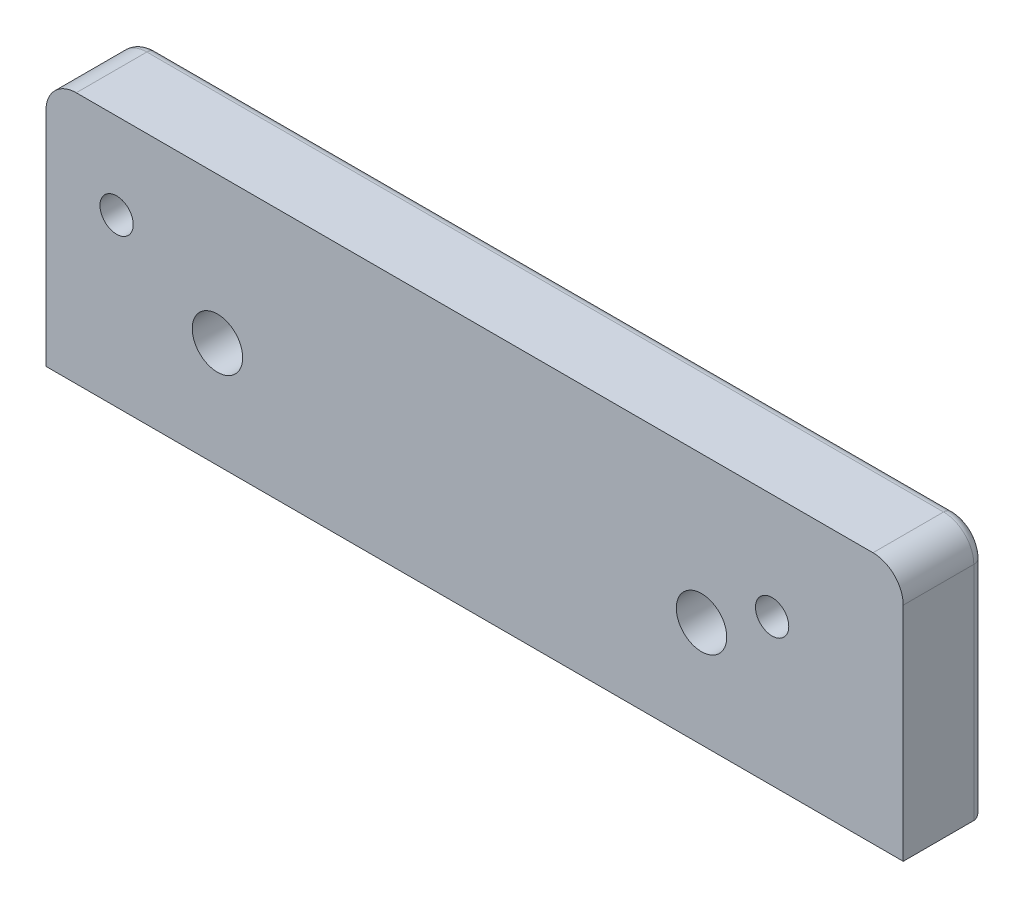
SolidWorks part; units mm, degrees
ref_plane "Plan1" through (0, 0, 0) normal (0, 0, 1) x (1, 0, 0)
ref_plane "Plan2" through (0, 0, 0) normal (0, 1, 0) x (1, 0, 0)
ref_plane "Plan3" through (0, 0, 0) normal (1, 0, 0) x (0, 0, -1)
sketch "Esquisse1" plane through (0, 0, 0) normal (0, 0, 1) x (1, 0, 0)
  line L0 (-42.5, -10.5) -> (42.5, -10.5)
  line L1 (-42.5, -10.5) -> (-42.5, 14.5)
  line L2 (42.5, 14.5) -> (-42.5, 14.5)
  line L3 (42.5, 14.5) -> (42.5, -10.5)
  dimension "D1" = 14.5
  dimension "D2" = 42.5
  dimension "D3" = 42.5
  dimension "D4" = 10.5
extrude "Base-Extrusion" add sketch "Esquisse1" along normal blind 8
fillet "Congé1" radius 3
fillet "Congé4" radius 1
sketch "Esquisse2" plane through (0, 0, 8) normal (0, 0, 1) x (1, 0, 0)
  line L0 (-25.5, 16) -> (-25.5, -15) construction
  line L1 (22.5, 16) -> (22.5, -19) construction
  line L2 (-37, 0) -> (34, 0) construction
  line L3 (-42.5, -10.5) -> (-42.5, 11.5) construction
  circle A0 centre (-25.5, 0) radius 2.5
  circle A1 centre (22.5, 0) radius 2.5
  dimension "D1" = 5
  dimension "D2" = 5
  dimension "D3" = 17
  dimension "D4" = 48
extrude "Enlèv. mat.-Extru.1" cut sketch "Esquisse2" against normal blind 8
sketch "Esquisse4" plane through (0, 0, 8) normal (0, 0, 1) x (1, 0, 0)
  line L0 (-46, 6) -> (-33, 6) construction
  line L1 (39.5, 14.5) -> (-39.5, 14.5) construction
  line L2 (-35.5, 15) -> (-35.5, 4) construction
  line L3 (-42.5, -10.5) -> (-42.5, 11.5) construction
  line L4 (29.5, 16) -> (29.5, 4) construction
  line L5 (28, 4) -> (42.5, 4) construction
  line L6 (42.5, 11.5) -> (42.5, -10.5) construction
  circle A0 centre (-35.5, 6) radius 1.65
  circle A1 centre (29.5, 4) radius 1.65
  dimension "D3" = 3.3
  dimension "D6" = 3.3
  dimension "D1" = 8.5
  dimension "D2" = 7
  dimension "D4" = 13
  dimension "D5" = 10.5
extrude "Enlèv. mat.-Extru.3" cut sketch "Esquisse4" against normal blind 8
sketch "Esquisse6" [suppressed] plane through (0, 0, 8) normal (0, 0, 1) x (1, 0, 0)
  line L0 (-22.5, 19) -> (-22.5, -16) construction
  line L1 (-42.5, -10.5) -> (-42.5, 11.5) construction
  dimension "D1" = 20
sketch "Esquisse7" plane through (0, -10.5, 0) normal (0, -1, 0) x (1, 0, 0)
  line L0 (24.5, 18) -> (24.5, -9) construction
  line L3 (42.5, 8) -> (42.5, 1) construction
  line L4 (-42.5, 8) -> (42.5, 8) construction
  point P4 (24.5, 10.15)
  dimension "D1" = 18
  dimension "D2" = 2.15
ref_plane "Plan4" [suppressed] through (-0.4122, 0, 9.0104) normal (-0.0457, 0, 0.999) x (0.999, 0, 0.0457)
sketch "Esquisse9" [suppressed] plane through (-0.4122, 0, 9.0104) normal (-0.0457, 0, 0.999) x (0.999, 0, 0.0457)
  line L0 (-27, -6) -> (33, -6) construction
  line L2 (-42.09, -10.5) -> (42.8212, -10.5) construction
  line L3 (-22.1109, -2.825) -> (24.8891, -2.825)
  line L4 (-22.1109, 19) -> (-22.1109, -16) construction
  line L5 (24.8891, 0) -> (24.8891, -7.9996) construction
  line L7 (-25.2859, -6) -> (28.0641, -6)
  arc A0 (-22.1109, -2.825) -> (-25.2859, -6) centre (-22.1109, -6) ccw
  arc A1 (24.8891, -2.825) -> (28.0641, -6) centre (24.8891, -6) cw
  dimension "D1" = 4.5
  dimension "D2" = 3.175
  dimension "D3" = 47
revolve "Enlever de la matière-Révolution2" [suppressed] cut sketch "Esquisse9" angle 360 about L0
ref_plane "Plan5" [suppressed] through (-0.4122, 0, 9.0104) normal (-0.0457, 0, 0.999) x (0.999, 0, 0.0457)
sketch "Esquisse11" [suppressed] plane through (-0.4122, 0, 9.0104) normal (-0.0457, 0, 0.999) x (0.999, 0, 0.0457)
  line L0 (-25.5035, 10) -> (28.2816, 10)
  line L3 (-26, 10) -> (29, 10) construction
  line L4 (39.8243, 14.5) -> (-39.0932, 14.5) construction
  line L5 (-22.1109, 6.825) -> (24.8891, 6.825)
  arc A0 (-22.1109, 6.825) -> (-25.5035, 10) centre (-22.1109, 10.225) cw
  arc A1 (24.8891, 6.825) -> (28.2816, 10) centre (24.8891, 10.225) ccw
  dimension "D1" = 4.5
  dimension "D2" = 3.175
  dimension "D3" = 47
revolve "Enlever de la matière-Révolution5" [suppressed] cut sketch "Esquisse11" angle 360 about L3
sketch "Esquisse12" plane through (0, 0, 0) normal (0, 0, -1) x (-1, 0, 0)
  circle A0 centre (-22.5, 0) radius 4.3
  circle A1 centre (25.5, 0) radius 4.3
  dimension "D1" = 8.6
  dimension "D2" = 8.6
extrude "Enlèv. mat.-Extru.6" cut sketch "Esquisse12" against normal blind 4
sketch "Esquisse13" plane through (37, 14.5, 2) normal (0, 1, 0) x (-1, 0, 0)
  line L0 (-5.6361, -1.7676) -> (-3.6361, -1.7676) construction
  line L1 (-5.1007, -2.2) -> (-4.3007, -2.2)
  line L2 (-5.1007, -2.2) -> (-4.7007, -1.8)
  line L3 (-4.7007, -1.8) -> (-4.3007, -2.2)
  line L4 (76.5, -2) -> (-2.5, -2) construction
  dimension "D1" = 0.4
  dimension "D2" = 0.2
extrude "Enlèv. mat.-Extru.7" cut sketch "Esquisse13" against normal through all
pattern_linear "Répétition linéaire1" count 85 spacing 1
